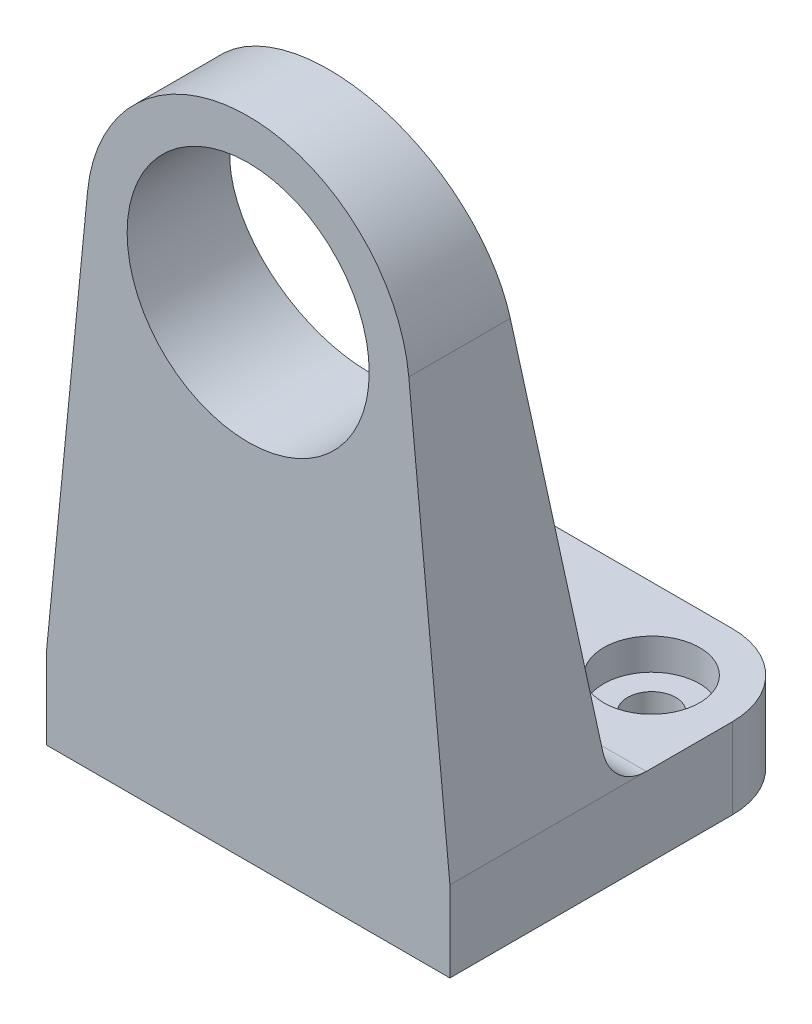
SolidWorks part; units mm, degrees
ref_plane "Front" through (0, 0, 0) normal (0, 0, 1) x (1, 0, 0)
ref_plane "Top" through (0, 0, 0) normal (0, 1, 0) x (1, 0, 0)
ref_plane "Right" through (0, 0, 0) normal (1, 0, 0) x (0, 0, -1)
sketch "Sketch1" plane through (0, 0, 0) normal (1, 0, 0) x (0, 0, -1)
  line L0 (0, 0) -> (28.575, 0)
  line L1 (28.575, 0) -> (28.575, 6.35)
  line L2 (28.575, 6.35) -> (12.7, 6.35)
  line L3 (12.7, 6.35) -> (6.35, 50.8)
  line L4 (6.35, 50.8) -> (0, 50.8)
  line L5 (0, 50.8) -> (0, 0)
  dimension "D1" = 6.35
  dimension "D2" = 6.35
  dimension "D3" = 12.7
  dimension "D4" = 28.575
  dimension "D5" = 50.8
extrude "Extrude1" add sketch "Sketch1" along normal mid plane 31.75
sketch "Sketch2" plane through (0, 0, 0) normal (0, 0, 1) x (1, 0, 0)
  line L0 (0, 0) -> (0, 44.9606) construction
  line L1 (15.875, 6.35) -> (12.6394, 39.3397)
  line L2 (-15.875, 6.35) -> (-12.6394, 39.3397)
  line L3 (15.875, 50.8) -> (-15.875, 50.8) construction
  line L4 (15.875, 6.35) -> (15.875, 0)
  line L5 (15.875, 50.8) -> (15.875, 0) construction
  line L6 (15.875, 0) -> (-15.875, 0)
  line L7 (-15.875, 0) -> (-15.875, 6.35)
  arc A0 (12.6394, 39.3397) -> (-12.6394, 39.3397) centre (0, 38.1) ccw
  dimension "D1" = 12.7
extrude "Cut-Extrude1" cut sketch "Sketch2" against normal through all flip side to cut
fillet "Fillet1" radius 3.175
sketch "Sketch3" plane through (0, 0, 0) normal (0, 0, 1) x (1, 0, 0)
  circle A0 centre (0, 38.1) radius 9.525
  dimension "D1" = 19.05
extrude "Cut-Extrude2" cut sketch "Sketch3" against normal through all
fillet "Fillet2" radius 6.35
hole_wizard "CBORE for #6 Pan Head Machine Screw1" positions "Sketch6" profile "Sketch5" counterbore size "#6" standard "Ansi Inch"
sketch "Sketch6" plane through (0, 6.35, 0) normal (0, 1, 0) x (-1, 0, 0)
  arc A3 (-15.875, -22.225) -> (-9.525, -28.575) centre (-9.525, -22.225) ccw construction
  arc A4 (9.525, -28.575) -> (15.875, -22.225) centre (9.525, -22.225) ccw construction
  point P0 (9.525, -22.225)
  point P8 (-9.525, -22.225)
sketch "Sketch5" plane through (-9.525, 6.35, -22.225) normal (1, 0, 0) x (0, 0, 1)
  line L0 (0, 0) -> (0, 6.35)
  line L1 (0, 6.35) -> (1.8986, 6.35)
  line L3 (1.8986, 6.35) -> (1.8987, 2.4638)
  line L4 (1.8987, 2.4638) -> (3.7706, 2.4638)
  line L5 (3.7706, 2.4638) -> (3.7706, 0)
  line L7 (3.7706, 0) -> (0, 0)
  line L11 (0, -6.35) -> (0, 107.95) construction
  dimension "Thru Hole Dia." = 3.7973
  dimension "Thru Hole Depth" = 6.35
  dimension "C'Bore Dia." = 7.5413
  dimension "C'Bore Depth" = 2.4638
